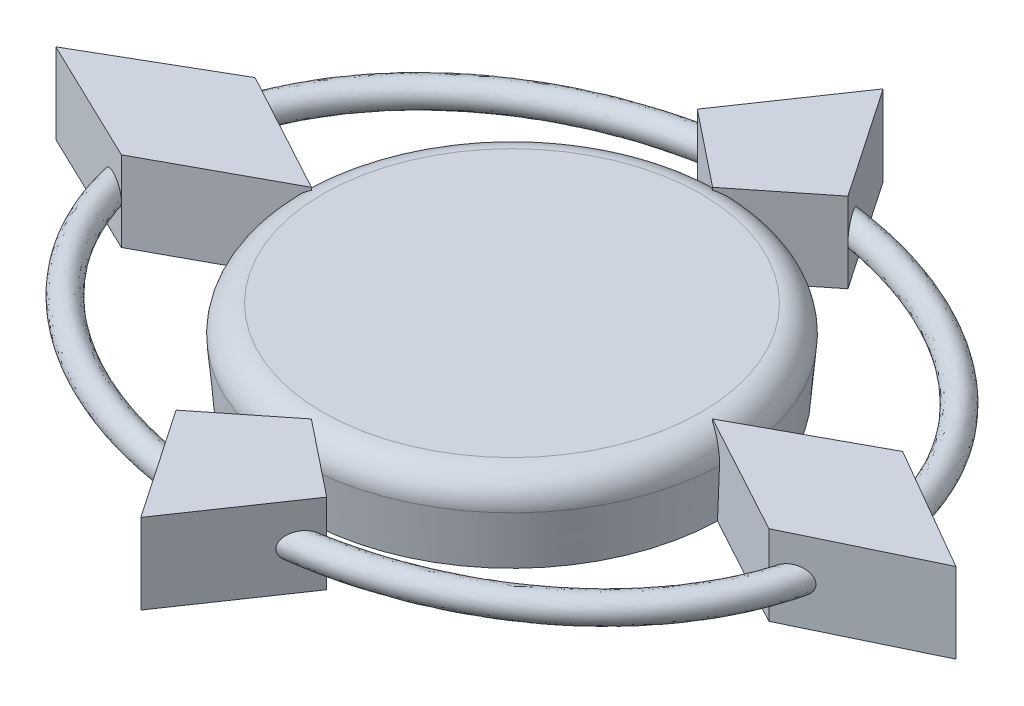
SolidWorks part; units mm, degrees
ref_plane "Front Plane" through (0, 0, 0) normal (0, 0, 1) x (1, 0, 0)
ref_plane "Top Plane" through (0, 0, 0) normal (0, 1, 0) x (1, 0, 0)
ref_plane "Right Plane" through (0, 0, 0) normal (1, 0, 0) x (0, 0, -1)
sketch "BaseSketch" plane through (0, 0, 0) normal (0, 1, 0) x (1, 0, 0)
  line L0 (0, 37.5) -> (14.0793, 48.7148)
  line L1 (14.0793, 48.7148) -> (0, 69.3733)
  line L2 (0, 69.3733) -> (-14.0793, 48.7148)
  line L3 (-14.0793, 48.7148) -> (0, 37.5)
  line L4 (37.5, 0) -> (60.5154, 12.5)
  line L5 (60.5154, 12.5) -> (84.1168, -1.1453)
  line L6 (84.1168, -1.1453) -> (60.5154, -12.5)
  line L7 (60.5154, -12.5) -> (37.5, 0)
  circle A0 centre (0, 0) radius 37.5 construction
  circle A1 centre (0, 0) radius 39.5
  ellipse E0 centre (0, 0) end of major axis (62.5, 0) minor radius 50
  dimension "D1" = 75
  dimension "D2" = 100
  dimension "D3" = 125
  dimension "D4" = 25
  dimension "D5" = 18
  dimension "D6" = 25
  dimension "D7" = 2
sketch "Sketch3" plane through (0, 0, 0) normal (0, 1, 0) x (1, 0, 0)
  circle A0 centre (0, 0) radius 39.5 construction
  circle A1 centre (0, 0) radius 39.5
extrude "Boss-Extrude1" add sketch "Sketch3" along normal blind 15 draft 5 contours A1
fillet "Fillet1" radius 5 1 edges at (0, 15, 40.8123)
sketch "Sketch4" plane through (0, 0, 0) normal (0, 1, 0) x (1, 0, 0)
  line L0 (60.5154, 12.5) -> (84.1168, -1.1453) construction
  line L1 (84.1168, -1.1453) -> (60.5154, -12.5) construction
  line L2 (60.5154, -12.5) -> (37.5, 0) construction
  line L3 (37.5, 0) -> (60.5154, 12.5) construction
  line L4 (14.0793, 48.7148) -> (0, 69.3733) construction
  line L5 (0, 69.3733) -> (-14.0793, 48.7148) construction
  line L6 (-14.0793, 48.7148) -> (0, 37.5) construction
  line L7 (0, 37.5) -> (14.0793, 48.7148) construction
  line L8 (60.5154, 12.5) -> (84.1168, -1.1453)
  line L9 (84.1168, -1.1453) -> (60.5154, -12.5)
  line L10 (60.5154, -12.5) -> (37.5, 0)
  line L11 (37.5, 0) -> (60.5154, 12.5)
  line L12 (14.0793, 48.7148) -> (0, 69.3733)
  line L13 (0, 69.3733) -> (-14.0793, 48.7148)
  line L14 (-14.0793, 48.7148) -> (0, 37.5)
  line L15 (0, 37.5) -> (14.0793, 48.7148)
  line L16 (0, 0) -> (0, 50) construction
  line L17 (0, 0) -> (-62.5, 0) construction
  line L18 (-14.0793, -48.7148) -> (0, -37.5)
  line L19 (0, -69.3733) -> (-14.0793, -48.7148)
  line L20 (14.0793, -48.7148) -> (0, -69.3733)
  line L21 (0, -37.5) -> (14.0793, -48.7148)
  line L22 (-60.5154, 12.5) -> (-84.1168, -1.1453)
  line L23 (-60.5154, -12.5) -> (-37.5, 0)
  line L24 (-84.1168, -1.1453) -> (-60.5154, -12.5)
  line L25 (-37.5, 0) -> (-60.5154, 12.5)
  ellipse E0 centre (0, 0) end of major axis (62.5, 0) minor radius 50 construction
  point P6 (0, 50)
  point P19 (-62.5, 0)
extrude "Boss-Extrude2" add sketch "Sketch4" along normal blind 15
ref_plane "Plane1" through (0, 7.5, 0) normal (0, -1, 0) x (-1, 0, 0)
sketch "Sketch5" plane through (0, 7.5, 0) normal (0, -1, 0) x (-1, 0, 0)
  ellipse E0 centre (0, 0) end of major axis (-62.5, 0) minor radius 50 construction
  ellipse E1 centre (0, 0) end of major axis (-62.5, 0) minor radius 50
sketch "Sketch6" plane through (0, 0, 0) normal (1, 0, 0) x (0, 0, -1)
  circle A0 centre (-52.5, 7.5) radius 2.5
  point P2 (-50, 7.5)
  point P3 (-50.8019, 7.6364)
  point P4 (0, 0)
  point P8 (0, 0)
  dimension "D1" = 5
sweep "Sweep1" add profiles "Sketch6" path "Sketch5"
